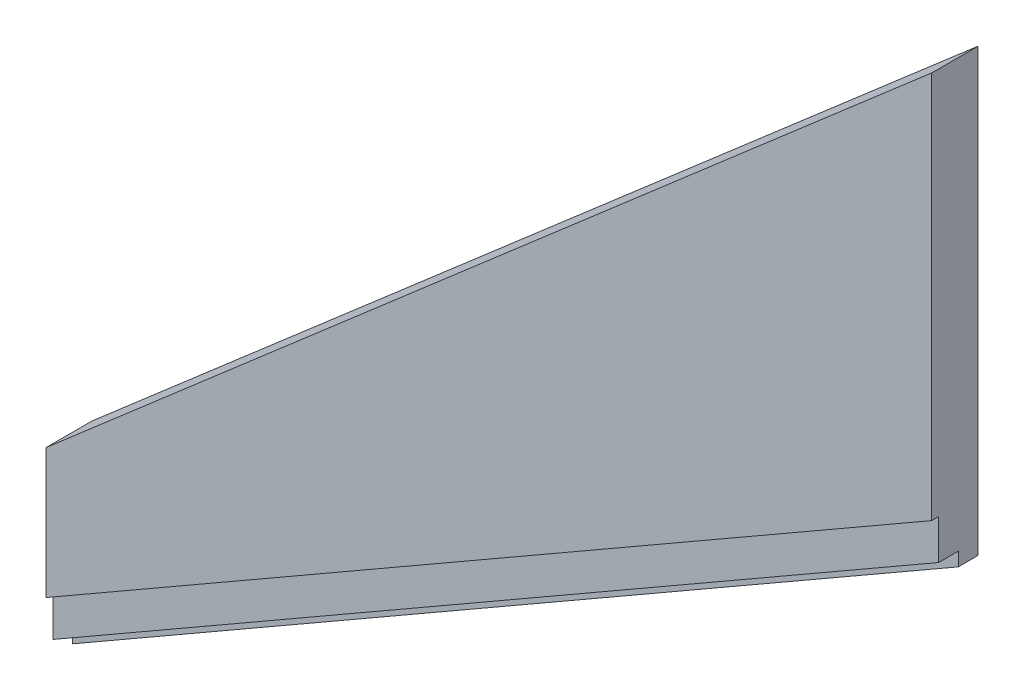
SolidWorks part; units mm, degrees
ref_plane "Спереди" through (0, 0, 0) normal (0, 0, 1) x (1, 0, 0)
ref_plane "Сверху" through (0, 0, 0) normal (0, 1, 0) x (1, 0, 0)
ref_plane "Справа" through (0, 0, 0) normal (1, 0, 0) x (0, 0, -1)
sketch "Эскиз1" plane through (0, 0, 0) normal (0, 0, 1) x (1, 0, 0)
  line L1 (0, -226.7832) -> (0, -620.7803)
  line L3 (-900, -1006.4871) -> (-900, -1138.4871)
  line L16 (0, -226.7832) -> (-900, -1006.4871)
  line L18 (0, -620.7803) -> (-900, -1138.4871)
extrude "Вытянуть1" add sketch "Эскиз1" along normal blind 47
sketch "Эскиз2" plane through (0, 0, 0) normal (0, 0, -1) x (-1, 0, 0)
  line L0 (0, -620.7803) -> (0, -661.1578)
  line L1 (900, -1138.4871) -> (900, -1178.8645)
  line L2 (900, -1178.8645) -> (0, -661.1578)
  line L3 (900, -1138.4871) -> (0, -620.7803) construction
  line L8 (900, -1006.4871) -> (0, -226.7832)
  line L9 (0, -226.7832) -> (0, -620.7803)
  line L10 (0, -620.7803) -> (900, -1138.4871)
  line L11 (900, -1138.4871) -> (900, -1006.4871)
  line L14 (0, -620.7803) -> (900, -1138.4871)
  dimension "D1" = 35
  dimension "D2" = 0
extrude "Вытянуть2" add sketch "Эскиз2" against normal blind 40
sketch "Эскиз3" plane through (0, 0, 0) normal (0, 0, -1) x (-1, 0, 0)
  line L0 (0, -661.1578) -> (0, -675.0015)
  line L1 (900, -1178.8645) -> (900, -1192.7082)
  line L2 (900, -1192.7082) -> (0, -675.0015)
  line L3 (0, -661.1578) -> (900, -1178.8645) construction
  line L8 (900, -1006.4871) -> (0, -226.7832)
  line L9 (0, -226.7832) -> (0, -661.1578)
  line L10 (0, -661.1578) -> (900, -1178.8645)
  line L11 (900, -1178.8645) -> (900, -1006.4871)
  line L14 (0, -661.1578) -> (900, -1178.8645)
  dimension "D1" = 12
  dimension "D2" = 0
extrude "Вытянуть3" add sketch "Эскиз3" against normal blind 20
